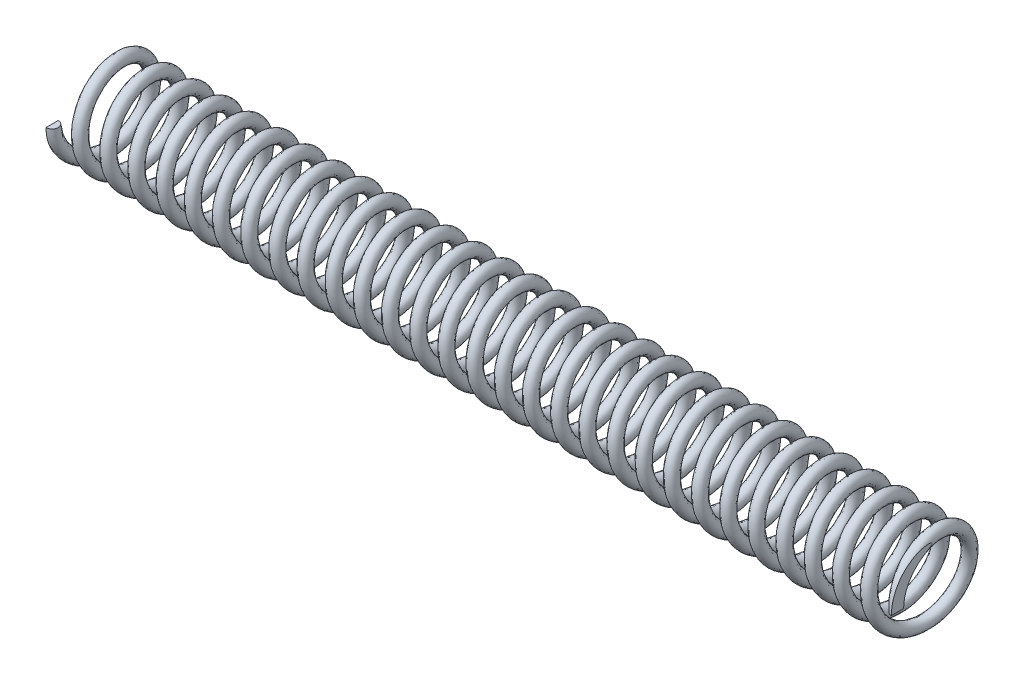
SolidWorks part; units mm, degrees
ref_plane "Front Plane" through (0, 0, 0) normal (0, 0, 1) x (1, 0, 0)
ref_plane "Top Plane" through (0, 0, 0) normal (0, 1, 0) x (1, 0, 0)
ref_plane "Right Plane" through (0, 0, 0) normal (1, 0, 0) x (0, 0, -1)
sketch "Sketch1" plane through (0, 0, 0) normal (0, 1, 0) x (1, 0, 0)
  line L0 (0, 0) -> (68.86, 0)
sketch "Sketch2" plane through (0, 0, 0) normal (0, 1, 0) x (1, 0, 0)
  circle A0 centre (0, -3.5) radius 0.5
  dimension "D1" = 1
  dimension "D2" = 3.5
sweep "Sweep1" add profiles "Sketch2" path "Sketch1" parameters "D1"=10800
sketch "Sketch3" plane through (0, 0, 0) normal (0, 0, 1) x (1, 0, 0)
  line L1 (0, 8.1186) -> (68.86, 8.1186)
  line L2 (0, 8.1186) -> (0, -8.1186)
  line L3 (0, -8.1186) -> (68.86, -8.1186)
  line L4 (68.86, 8.1186) -> (68.86, -8.1186)
  dimension "D1" = 68.86
extrude "Cut-Extrude1" cut sketch "Sketch3" against normal through all and the other way through all flip side to cut
